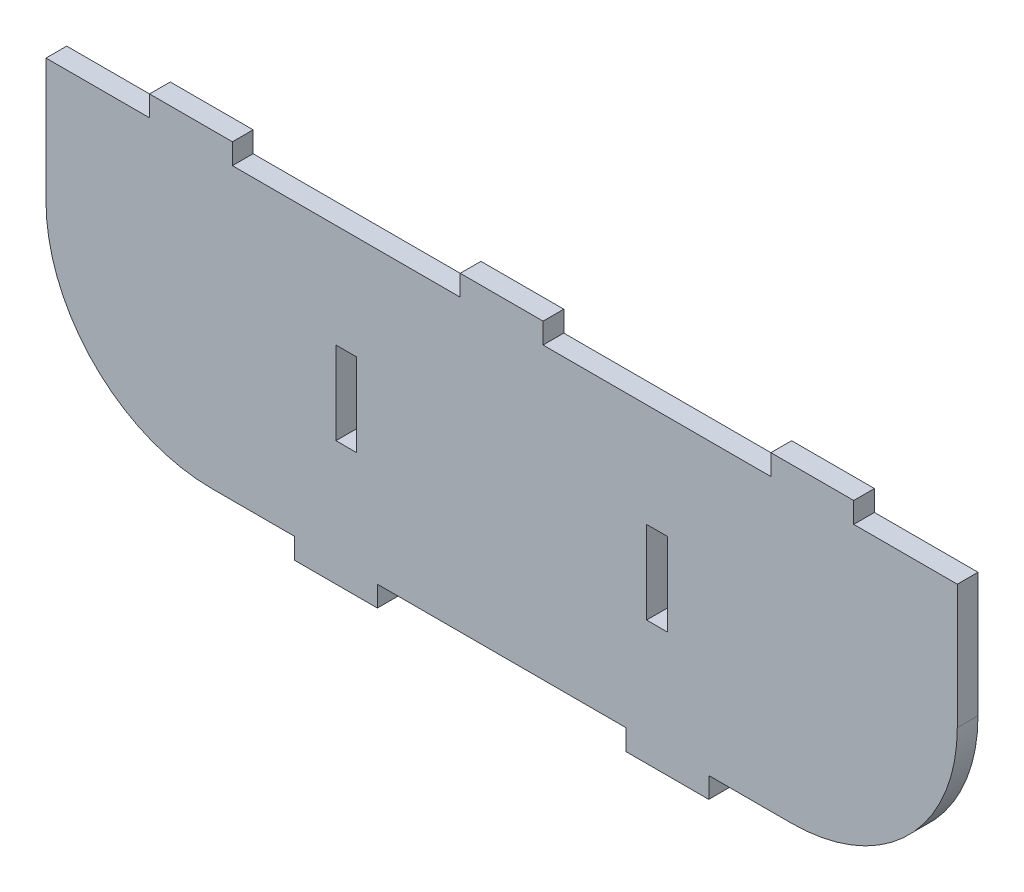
SolidWorks part; units mm, degrees
ref_plane "Front Plane" through (0, 0, 0) normal (0, 0, 1) x (1, 0, 0)
ref_plane "Top Plane" through (0, 0, 0) normal (0, 1, 0) x (1, 0, 0)
ref_plane "Right Plane" through (0, 0, 0) normal (1, 0, 0) x (0, 0, -1)
sketch "Sketch1" plane through (0, 0, 0) normal (0, 0, 1) x (1, 0, 0)
  line L1 (-44.45, -22.225) -> (44.45, -22.225)
  line L2 (-69.85, 3.175) -> (-69.85, 22.225)
  line L3 (-69.85, 22.225) -> (69.85, 22.225)
  line L4 (69.85, 3.175) -> (69.85, 22.225)
  line L5 (-69.85, -22.225) -> (69.85, 22.225) construction
  line L6 (-69.85, 22.225) -> (69.85, -22.225) construction
  arc A0 (69.85, 3.175) -> (44.45, -22.225) centre (44.45, 3.175) cw
  arc A1 (-44.45, -22.225) -> (-69.85, 3.175) centre (-44.45, 3.175) cw
  point P0 (0, 0)
extrude "Boss-Extrude1" add sketch "Sketch1" along normal mid plane 3.175
sketch "Sketch2" plane through (0, 0, 1.5875) normal (0, 0, 1) x (1, 0, 0)
  line L0 (-44.45, -22.225) -> (44.45, -22.225) construction
  line L1 (-31.75, -22.225) -> (-19.05, -22.225)
  line L2 (-31.75, -22.225) -> (-31.75, -25.4)
  line L3 (-31.75, -25.4) -> (-19.05, -25.4)
  line L4 (-19.05, -22.225) -> (-19.05, -25.4)
  line L5 (-25.4, -25.4) -> (-25.4, -22.225) construction
  line L6 (-69.85, 22.225) -> (-69.85, 3.175) construction
  line L7 (69.85, 22.225) -> (-69.85, 22.225) construction
  line L8 (-71.4375, 22.225) -> (-23.8125, 22.225) construction
  line L9 (-23.8125, 22.225) -> (23.8125, 22.225) construction
  line L10 (23.8125, 22.225) -> (71.4375, 22.225) construction
  line L12 (-47.625, 22.225) -> (-47.625, 25.4) construction
  line L13 (-25.4, -22.225) -> (0, -22.225) construction
  line L14 (0, -22.225) -> (25.4, -22.225) construction
  line L15 (25.4, -22.225) -> (25.4, -25.4) construction
  line L16 (0, 0) -> (0, 25.4) construction
  line L17 (19.05, -25.4) -> (31.75, -25.4)
  line L18 (19.05, -25.4) -> (19.05, -22.225)
  line L19 (19.05, -22.225) -> (31.75, -22.225)
  line L20 (31.75, -25.4) -> (31.75, -22.225)
  line L21 (-53.975, 22.225) -> (-41.275, 22.225)
  line L22 (-53.975, 22.225) -> (-53.975, 25.4)
  line L23 (-53.975, 25.4) -> (-41.275, 25.4)
  line L24 (-41.275, 22.225) -> (-41.275, 25.4)
  line L25 (-6.35, 22.225) -> (6.35, 22.225)
  line L26 (-6.35, 22.225) -> (-6.35, 25.4)
  line L27 (-6.35, 25.4) -> (6.35, 25.4)
  line L28 (6.35, 22.225) -> (6.35, 25.4)
  line L29 (41.275, 22.225) -> (53.975, 22.225)
  line L30 (41.275, 22.225) -> (41.275, 25.4)
  line L31 (41.275, 25.4) -> (53.975, 25.4)
  line L32 (53.975, 22.225) -> (53.975, 25.4)
  line L33 (47.625, 22.225) -> (47.625, 25.4) construction
  point P8 (0, 22.225)
extrude "Boss-Extrude2" add sketch "Sketch2" against normal up to surface (3.175 mm away)
sketch "Sketch3" plane through (0, 0, 1.5875) normal (0, 0, 1) x (1, 0, 0)
  line L0 (-23.8125, 22.225) -> (-23.8125, -22.225) construction
  line L1 (-25.4, -22.225) -> (0, -22.225) construction
  line L3 (-25.4, 6.35) -> (-22.225, 6.35)
  line L4 (-25.4, 6.35) -> (-25.4, -6.35)
  line L5 (-25.4, -6.35) -> (-22.225, -6.35)
  line L6 (-22.225, 6.35) -> (-22.225, -6.35)
  line L7 (-25.4, 6.35) -> (-22.225, -6.35) construction
  line L8 (-25.4, -6.35) -> (-22.225, 6.35) construction
  point P5 (-23.8125, 0)
extrude "Cut-Extrude1" cut sketch "Sketch3" against normal through all
mirror "Mirror1" about plane through (0, 0, 0) normal (1, 0, 0) of "Cut-Extrude1"
equation "\"h\"= 5"
equation "\"plywoodThickness\"= .125"
equation "\"jointClearance\"= .000"
equation "\"D1@Sketch1\"=6-(4*\"plywoodThickness\")"
equation "\"D3@Sketch1\"=2-(2*\"plywoodThickness\")"
equation "\"D1@Boss-Extrude1\"=\"plywoodThickness\""
equation "\"D3@Sketch2\"=\"plywoodThickness\""
equation "\"D4@Sketch2\"=\"plywoodThickness\"/2"
equation "\"D1@Sketch3\"=.5 + \"jointClearance\""
equation "\"D2@Sketch3\"=\"plywoodThickness\"+\"jointClearance\""
